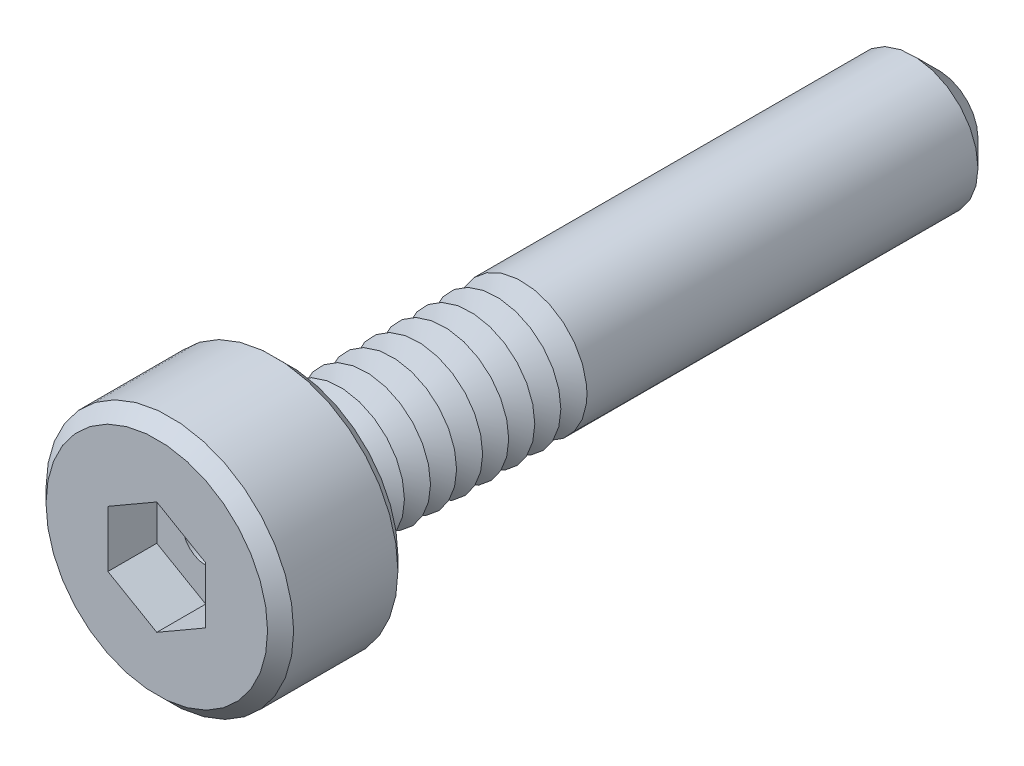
SolidWorks part; units mm, degrees
ref_plane "Front Plane" through (0, 0, 0) normal (0, 0, 1) x (1, 0, 0)
ref_plane "Top Plane" through (0, 0, 0) normal (0, 1, 0) x (1, 0, 0)
ref_plane "Right Plane" through (0, 0, 0) normal (1, 0, 0) x (0, 0, -1)
sketch "Sketch1" plane through (0, 0, 0) normal (0, 0, 1) x (1, 0, 0)
  circle A0 centre (0, 0) radius 1.9
  dimension "D1" = 3.8
extrude "Boss-Extrude1" add sketch "Sketch1" along normal blind 2
sketch "Sketch2" plane through (0, 0, 0) normal (0, 0, -1) x (-1, 0, 0)
  circle A0 centre (0, 0) radius 1
  dimension "D1" = 2
extrude "Boss-Extrude2" add sketch "Sketch2" along normal blind 10
chamfer "Chamfer1" distance 0.4 angle 45 1 edges at (-1, 0, -10)
sketch "Sketch3" plane through (0, 0, 0) normal (1, 0, 0) x (0, 0, -1)
  line L0 (-2.5121, 0) -> (4.5776, 0) construction
sketch "Sketch4" plane through (0, 0, 0) normal (1, 0, 0) x (0, 0, -1)
  line L0 (0, 1) -> (0.2, 0.6536)
  line L1 (0.2, 0.6536) -> (0.4, 1)
  line L2 (9.6, 1) -> (0, 1) construction
  line L3 (0.4, 1) -> (0, 1)
  dimension "D1" = 0.4
revolve "Cut-Revolve1" cut sketch "Sketch4" angle 360 about L0
pattern_linear "LPattern1" count 9 spacing 0.4 along (0, 0, -1) of "Cut-Revolve1"
sketch "Sketch5" plane through (0, 0, 2) normal (0, 0, 1) x (1, 0, 0)
  line L1 (0, 0.866) -> (-0.75, 0.433)
  line L2 (-0.75, 0.433) -> (-0.75, -0.433)
  line L3 (-0.75, -0.433) -> (0, -0.866)
  line L4 (0, -0.866) -> (0.75, -0.433)
  line L5 (0.75, -0.433) -> (0.75, 0.433)
  line L6 (0.75, 0.433) -> (0, 0.866)
  circle A0 centre (0, 0) radius 0.75 construction
  dimension "D1" = 1.5
extrude "Cut-Extrude1" cut sketch "Sketch5" against normal blind 0.75
sketch "Sketch6" plane through (0, 0, 1.25) normal (0, 0, 1) x (1, 0, 0)
  circle A0 centre (0, 0) radius 0.35
  dimension "D1" = 0.7
extrude "Cut-Extrude2" cut sketch "Sketch6" against normal up to surface (11.25 mm away)
chamfer "Chamfer2" distance 0.2 angle 45 2 edges at (1.9, 0, 0) (1.9, 0, 2)
